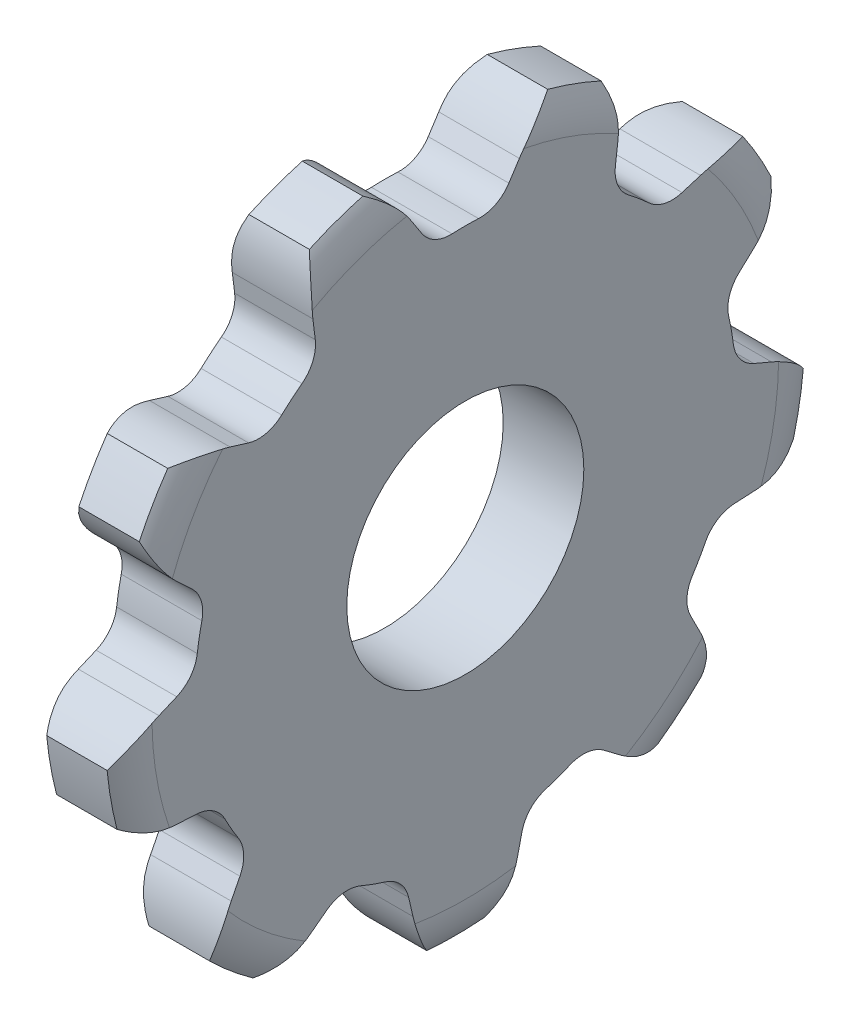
SolidWorks part; units mm, degrees
ref_plane "Plane1" through (0, 0, 0) normal (0, 0, 1) x (1, 0, 0)
ref_plane "Plane2" through (0, 0, 0) normal (0, 1, 0) x (1, 0, 0)
ref_plane "Plane3" through (0, 0, 0) normal (1, 0, 0) x (0, 0, -1)
other "Configuration Table"
sketch "Clipboard" plane through (0, 0, 0) normal (0, 1, 0) x (1, 0, 0)
  line L0 (0, 0) -> (22.6789, -3.592)
  line L1 (-15, 0) -> (100, 0) construction
  line L2 (0, 0) -> (-2.1039, 2.3779)
  line L3 (0, 0) -> (-11.863, 4.5341)
  line L4 (0, 0) -> (8.5297, 1.351)
  line L5 (0, 0) -> (-20.9428, -7.811)
  line L6 (0, 0) -> (-7.1589, -4.8301)
  line L7 (-2.1039, 2.3779) -> (2.7074, 24.206)
  line L8 (-76.2, 54.61) -> (-47.9044, 54.61)
  line L9 (-67.0794, 25.4907) -> (-62.6246, 26.5192)
  line L10 (-76.2, 71.12) -> (-42.6324, 71.12)
  circle A0 centre (0, 0) radius 7.9375
  circle A1 centre (0, 0) radius 25.4
  circle A2 centre (0, 0) radius 25.4
sketch "BasProSke" plane through (0, 0, 0) normal (0, 1, 0) x (1, 0, 0)
  line L0 (-10, 0) -> (60, 0) construction
  line L1 (0, 0) -> (0, 33.5676)
  line L2 (0, 0) -> (8.636, 0)
  line L3 (8.636, 0) -> (8.636, 33.5676)
  line L4 (7.5565, 37.4538) -> (1.0795, 37.4538)
  arc A0 (0, 33.5676) -> (1.0795, 37.4538) centre (7.5349, 33.5676) cw
  arc A1 (8.636, 33.5676) -> (7.5565, 37.4538) centre (1.1011, 33.5676) ccw
revolve "Base-Revolve" add sketch "BasProSke" angle 360 about L0
sketch "TooCutSke" plane through (0, 0, 0) normal (1, 0, 0) x (0, 0, -1)
  line L0 (-4.6667, 30.5715) -> (-5.7922, 32.3047)
  line L1 (0, 0) -> (0, 107) construction
  line L2 (1.1481, 0) -> (1.1481, 288.74) construction
  line L3 (4.6667, 30.5715) -> (5.7922, 32.3047)
  line L5 (1.1481, 35.3206) -> (42.4634, 8.4901) construction
  arc A0 (1.4197, 28.9104) -> (-1.4197, 28.9104) centre (0, 0) ccw
  arc A1 (1.4197, 28.9104) -> (4.6667, 30.5715) centre (1.5991, 32.5636) ccw
  arc A2 (-1.4197, 28.9104) -> (-4.6667, 30.5715) centre (-1.5991, 32.5636) cw
  circle A3 centre (0, 0) radius 33.5676 construction
  circle A4 centre (1.1481, 33.548) radius 4.572 construction
  arc A5 (5.7922, 32.3047) -> (13.6084, 37.3886) centre (15.4208, 26.0518) cw
  arc A6 (-5.7922, 32.3047) -> (-13.6084, 37.3886) centre (-15.4208, 26.0518) ccw
  arc A7 (13.6084, 37.3886) -> (-13.6084, 37.3886) centre (0, 0) ccw
extrude "ToothCut" cut sketch "TooCutSke" along normal through all
pattern_circular "TeethCuts" count 9 every 40 about axis through (-10, 0, 0) along (1, 0, 0) of "ToothCut"
sketch "HubNeaOneSke" plane through (0, 0, 0) normal (-1, 0, 0) x (0, 0, 1)
  circle A0 centre (0, 0) radius 25.4
extrude "HubNearOne" [suppressed] add sketch "HubNeaOneSke" along normal blind 13.7161
sketch "HubNeaBotSke" plane through (0, 0, 0) normal (-1, 0, 0) x (0, 0, 1)
  circle A0 centre (0, 0) radius 25.4
extrude "HubNearBoth" [suppressed] add sketch "HubNeaBotSke" along normal blind 6.858
ref_plane "FarPln" through (8.636, 0, 0) normal (1, 0, 0) x (0, 0, -1)
sketch "HubFarSke" plane through (8.636, 0, 0) normal (1, 0, 0) x (0, 0, -1)
  circle A0 centre (0, 0) radius 25.4
extrude "HubFar" [suppressed] add sketch "HubFarSke" along normal blind 6.858
sketch "BorSke" plane through (0, 0, 0) normal (1, 0, 0) x (0, 0, -1)
  circle A0 centre (0, 0) radius 12.7
extrude "Bore" cut sketch "BorSke" along normal mid plane 44.7041
sketch "KeySke" plane through (0, 0, 0) normal (1, 0, 0) x (0, 0, -1)
  line L0 (-3.175, 0) -> (-3.175, 15.5956)
  line L1 (-3.175, 15.5956) -> (3.175, 15.5956)
  line L2 (3.175, 15.5956) -> (3.175, 0)
  line L3 (0, 0) -> (0, 34) construction
  line L4 (-3.175, 0) -> (3.175, 0)
extrude "Keyway" [suppressed] cut sketch "KeySke" along normal mid plane 44.7041
pattern_circular "Keyway2" [suppressed] count 2 every 90 about axis through (-10, 0, 0) along (1, 0, 0)
equation "\"Num_teeth@Clipboard\" = int( \"Num_teeth@Clipboard\" )"
equation "\"Num_teeth@Clipboard\" = ((sgn( \"Num_teeth@Clipboard\" - 5.0)+1)*( \"Num_teeth@Clipboard\" - 5.0))/2 +5.0"
equation "' \"Num_teeth@Clipboard\" = ((sgn( \"Num_teeth@Clipboard\" - 200.0)-1)*( \"Num_teeth@Clipboard\" - 200.0))/-2 +200.0"
equation "\"OAL@Clipboard\" = \"Thickness@Clipboard\""
equation "\"Pitch_radius@Clipboard\" = ( \"Pitch@Clipboard\" / 2.0) / sin(3.14159265 / \"Num_teeth@Clipboard\" )"
equation "\"MHD@Clipboard\" =2.0 * ( \"Pitch_radius@Clipboard\" * 0.9985 -  \"H@Clipboard\" )"
equation "\"MHD@Clipboard\" = ((sgn( \"MHD@Clipboard\" - \"Hub_dia@Clipboard\" )-1)*( \"MHD@Clipboard\" - \"Hub_dia@Clipboard\" ))/-2+ \"Hub_dia@Clipboard\""
equation "\"OAL@Clipboard\" = ((sgn( \"OAL@Clipboard\" - \"Overall_len@Clipboard\" )+1)*( \"OAL@Clipboard\" - \"Overall_len@Clipboard\" ))/2 + \"Overall_len@Clipboard\" + 0.000002"
equation "\"Num_teeth@TeethCuts\" = int( \"Show_teeth@Clipboard\" ) + 1"
equation "\"Num_teeth@TeethCuts\" = ((sgn( \"Num_teeth@TeethCuts\" - \"Num_teeth@Clipboard\" )-1)*( \"Num_teeth@TeethCuts\" - \"Num_teeth@Clipboard\" ))/-2+ \"Num_teeth@Clipboard\""
equation "\"Num_teeth@TeethCuts\" = ((sgn( \"Num_teeth@TeethCuts\" - 2.0)+1)*( \"Num_teeth@TeethCuts\" - 2.0))/2 +2.0"
equation "\"Angle@TeethCuts\" = 360.0 / \"Num_teeth@Clipboard\""
equation "\"Pitch_radius@TooCutSke\" = \"Pitch_radius@Clipboard\""
equation "\"Cp@TooCutSke\" = 0.05 * \"Pitch@Clipboard\""
equation "\"Rt@TooCutSke\" = 0.5 * \"Pitch@Clipboard\""
equation "\"R@TooCutSke\"  = 0.8 * \"H@Clipboard\""
equation "\"Dr@TooCutSke\" = \"Pitch_radius@Clipboard\" * 0.9985 -  \"H@Clipboard\""
equation "\"Ag@TooCutSke\" =  2.0 * \"Ap@Clipboard\" + 360.0 / \"Num_teeth@Clipboard\""
equation "\"L@TooCutSke\" = 0.01 * \"Pitch@Clipboard\" * \"Num_teeth@Clipboard\""
equation "\"H@TooCutSke\" = \"H@Clipboard\""
equation "\"Angle@TooCutSke\" =  360.0 / \"Num_teeth@Clipboard\""
equation "\"Diameter@BasProSke\" = 2.0 * \"Pitch_radius@Clipboard\"  + 1.7 * \"H@Clipboard\""
equation "\"Thickness@BasProSke\"  = \"Thickness@Clipboard\""
equation "\"G1@BasProSke\" =  \"Thickness@Clipboard\" * 0.125"
equation "\"G2@BasProSke\" =   \"Thickness@Clipboard\" * 0.125"
equation "\"H1@BasProSke\" =  \"Diameter@BasProSke\" / 2.0 - \"Pitch_radius@Clipboard\""
equation "\"H2@BasProSke\" =  \"Diameter@BasProSke\" / 2.0 - \"Pitch_radius@Clipboard\""
equation "\"Diameter@HubNeaOneSke\" = \"MHD@Clipboard\""
equation "\"Length@HubNearOne\" = \"OAL@Clipboard\" - \"Thickness@BasProSke\""
equation "\"Diameter@HubNeaBotSke\" = \"MHD@Clipboard\""
equation "\"Length@HubNearBoth\" = ( \"OAL@Clipboard\" - \"Thickness@BasProSke\" ) / 2.0"
equation "\"Thickness@FarPln\" = \"Thickness@BasProSke\""
equation "\"Diameter@HubFarSke\" = \"MHD@Clipboard\""
equation "\"Length@HubFar\" = ( \"OAL@Clipboard\" - \"Thickness@BasProSke\" ) / 2.0"
equation "\"D1@Bore\" = \"OAL@Clipboard\" * 2.0"
equation "\"D1@Keyway\" = \"OAL@Clipboard\" * 2.0"
equation "\"Offset@KeySke\" = \"T_dim@Clipboard\" - \"Diameter@BorSke\" / 2.0"
